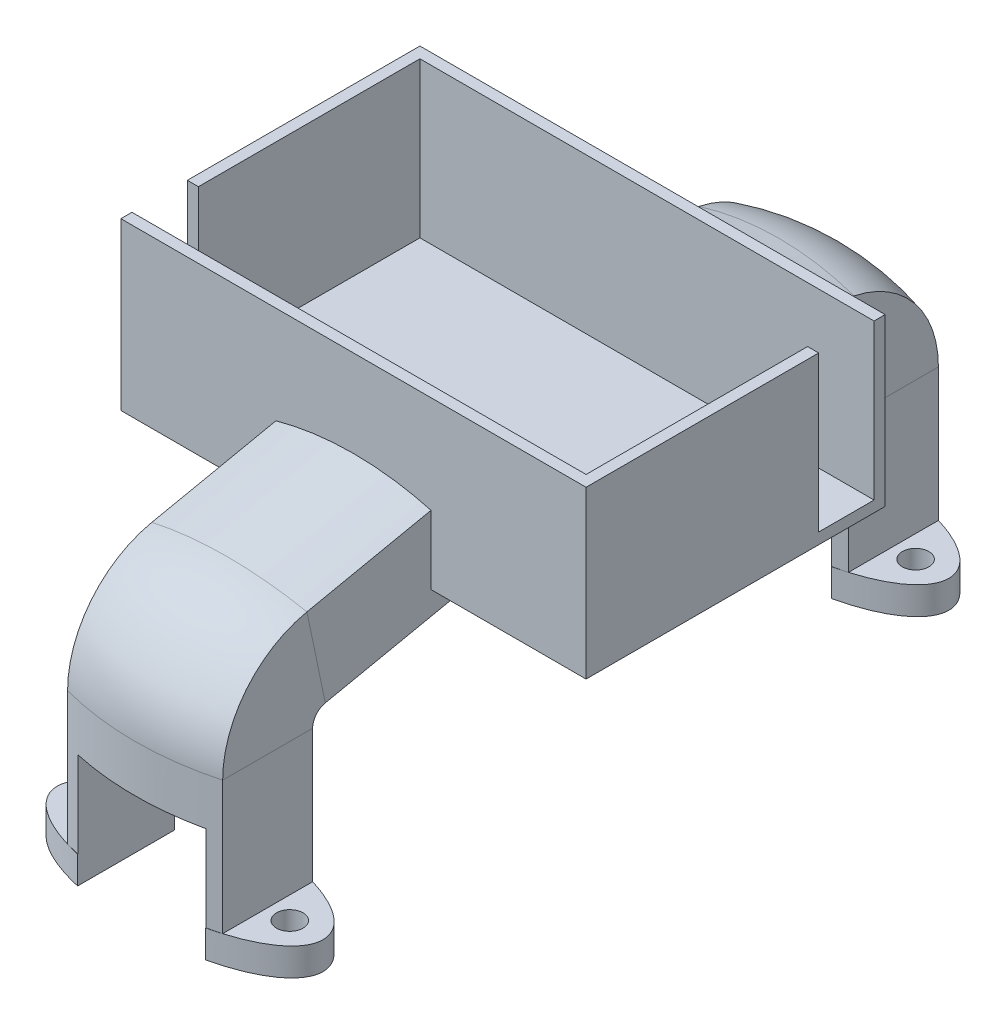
SolidWorks part; units mm, degrees
ref_plane "Front Plane" through (0, 0, 0) normal (0, 0, 1) x (1, 0, 0)
ref_plane "Top Plane" through (0, 0, 0) normal (0, 1, 0) x (1, 0, 0)
ref_plane "Right Plane" through (0, 0, 0) normal (1, 0, 0) x (0, 0, -1)
sketch "Sketch2" plane through (0, 0, 0) normal (0, 1, 0) x (1, 0, 0)
  ellipse E0 centre (0, 0) end of major axis (12, 0) minor radius 5
extrude "Boss-Extrude1" add sketch "Sketch2" along normal blind 2.5
sketch "Sketch3" plane through (0, 2.5, 0) normal (0, 1, 0) x (1, 0, 0)
  circle A0 centre (9, 0) radius 1.2
  circle A1 centre (-9, 0) radius 1.2
  dimension "D1" = 18
  dimension "D2" = 9
extrude "Cut-Extrude1" cut sketch "Sketch3" against normal blind 2.5
sketch "Sketch10" plane through (0, 2.5, 0) normal (0, 1, 0) x (1, 0, 0)
  line L0 (-7, -4.0612) -> (-7, 4.0612)
  line L1 (7, -4.0612) -> (7, 4.0612)
  arc A0 (-7, 4.0612) -> (7, 4.0612) centre (0, -21.915) cw
  arc A1 (-7, -4.0612) -> (7, -4.0612) centre (0, 21.9152) ccw
  ellipse E0 centre (0, 0) end of major axis (12, 0) minor radius 5 construction
  point P0 (7, 0)
  point P1 (-7, 0)
  point P12 (-7, 0)
  point P15 (7, 0)
  point P16 (0, -5)
  dimension "D1" = 7
  dimension "D2" = 7
extrude "Boss-Extrude3" add sketch "Sketch10" along normal blind 9
ref_plane "Plane1" through (0, 0, 10) normal (0, 0, 1) x (1, 0, 0)
sketch "Sketch11" plane through (0, 0, 10) normal (0, 0, 1) x (1, 0, 0)
  line L0 (-5.775, 0) -> (5.775, 0)
  line L1 (15.1989, 0) -> (-15.1989, 0) construction
  line L2 (5.775, 0) -> (5.775, 10.25)
  line L3 (5.775, 10.25) -> (-5.775, 10.25)
  line L4 (-5.775, 10.25) -> (-5.775, 0)
  point P6 (0, 0)
  dimension "D1" = 5.775
extrude "Cut-Extrude3" cut sketch "Sketch11" against normal blind 20
sketch "Sketch12" plane through (0, 0, 0) normal (0, 1, 0) x (1, 0, 0)
  ellipse E0 centre (0, 56.5) end of major axis (12, 56.5) minor radius 5
  dimension "D1" = 56.5
extrude "Boss-Extrude4" add sketch "Sketch12" along normal blind 2.5 separate body
sketch "Sketch14" plane through (0, 2.5, 0) normal (0, 1, 0) x (1, 0, 0)
  circle A0 centre (9, 56.5) radius 1.2
  circle A1 centre (-9, 56.5) radius 1.2
  ellipse E0 centre (0, 56.5) end of major axis (12, 56.5) minor radius 5 construction
  point P0 (-12, 56.5)
  point P1 (0, 56.5)
  point P13 (12, 56.5)
  dimension "D1" = 18
  dimension "D2" = 3
extrude "Cut-Extrude4" cut sketch "Sketch14" against normal blind 2.5
sketch "Sketch16" plane through (0, 2.5, 0) normal (0, 1, 0) x (1, 0, 0)
  line L0 (-7, 60.5612) -> (-7, 52.4388)
  line L1 (7, 60.5612) -> (7, 52.4388)
  arc A0 (-7, 60.5612) -> (7, 60.5612) centre (0, 34.9344) cw
  arc A1 (-7, 52.4388) -> (7, 52.4388) centre (0, 78.0656) ccw
  ellipse E0 centre (0, 56.5) end of major axis (12, 56.5) minor radius 5 construction
  point P8 (0, 56.5)
  point P13 (7, 56.4287)
  dimension "D1" = 7
extrude "Boss-Extrude5" add sketch "Sketch16" along normal blind 9
ref_plane "Plane2" through (0, 20, 0) normal (0, 1, 0) x (1, 0, 0)
sketch "Sketch17" plane through (0, 20, 0) normal (0, 1, 0) x (1, 0, 0)
  line L0 (-20, 15.75) -> (-20, 40.75)
  line L1 (-20, 15.75) -> (20, 15.75)
  line L2 (-20, 40.75) -> (20, 40.75)
  line L3 (20, 15.75) -> (20, 40.75)
  line L4 (-20, 15.75) -> (20, 40.75) construction
  line L5 (-20, 40.75) -> (20, 15.75) construction
  line L6 (-21, 14.75) -> (-21, 41.75)
  line L7 (-21, 14.75) -> (21, 14.75)
  line L8 (-21, 41.75) -> (21, 41.75)
  line L9 (21, 14.75) -> (21, 41.75)
  line L10 (-21, 14.75) -> (21, 41.75) construction
  line L11 (-21, 41.75) -> (21, 14.75) construction
  point P0 (0, 28.25)
  point P2 (0, 28.25)
  point P3 (0, 28.25)
extrude "Boss-Extrude6" add sketch "Sketch17" along normal blind 15 separate body
sketch "Sketch18" plane through (0, 20, 0) normal (0, 1, 0) x (1, 0, 0)
  line L1 (-20, 40.75) -> (20, 40.75)
  line L2 (-20, 40.75) -> (-20, 15.75)
  line L3 (-20, 15.75) -> (20, 15.75)
  line L4 (20, 40.75) -> (20, 15.75)
extrude "Boss-Extrude7" add sketch "Sketch18" along normal blind 1.5
ref_plane "Plane3" through (0, 0, -50) normal (0, 0, 1) x (1, 0, 0)
sketch "Sketch19" plane through (0, 0, -50) normal (0, 0, 1) x (1, 0, 0)
  line L0 (-5.775, 0) -> (5.775, 0)
  line L2 (5.775, 0) -> (5.775, 10.25)
  line L3 (5.775, 10.25) -> (-5.775, 10.25)
  line L4 (-5.775, 10.25) -> (-5.775, 0)
  point P6 (0, 0)
  dimension "D1" = 5.775
extrude "Cut-Extrude5" cut sketch "Sketch19" against normal blind 13
sketch "Sketch20" plane through (0, 11.5, 0) normal (0, 1, 0) x (1, 0, 0)
  line L0 (-7, 60.5612) -> (-7, 52.4388)
  line L1 (7, 60.5612) -> (7, 52.4388)
  arc A0 (-7, 60.5612) -> (7, 60.5612) centre (0, 34.9344) cw
  arc A1 (-7, 52.4388) -> (7, 52.4388) centre (0, 78.0656) ccw
  point P10 (7, 56.5)
  point P11 (0, 56.5)
  point P12 (0, 61.5)
sketch "Sketch21" plane through (0, 0, 0) normal (1, 0, 0) x (0, 0, -1)
  line L0 (56.5, 11.5) -> (56.5, 14.5)
  line L4 (52.1232, 19.8841) -> (34.5025, 23.56)
  arc A0 (56.5, 14.5) -> (52.1232, 19.8841) centre (51, 14.5) ccw
  dimension "D1" = 5.5
sweep "Sweep6" add profiles "Sketch20" path "Sketch21"
sketch "Sketch32" plane through (0, 11.5, 0) normal (0, 1, 0) x (1, 0, 0)
  line L0 (-7, 4.0612) -> (-7, -4.0612)
  line L1 (7, 4.0612) -> (7, -4.0612)
  arc A0 (-7, 4.0612) -> (7, 4.0612) centre (0, -21.915) cw
  arc A1 (-7, -4.0612) -> (7, -4.0612) centre (0, 21.9152) ccw
sketch "Sketch33" plane through (0, 0, 0) normal (1, 0, 0) x (0, 0, -1)
  line L4 (4.3768, 19.8841) -> (21.9975, 23.56)
  line L5 (0, 11.5) -> (0, 14.5)
  arc A1 (0, 14.5) -> (4.3768, 19.8841) centre (5.5, 14.5) cw
sweep "Sweep7" add profiles "Sketch32" path "Sketch33"
sketch "Sketch34" plane through (0, 35, 0) normal (0, 1, 0) x (1, 0, 0)
  line L1 (-20, 40.75) -> (20, 40.75)
  line L2 (-20, 40.75) -> (-20, 15.75)
  line L3 (-20, 15.75) -> (20, 15.75)
  line L4 (20, 40.75) -> (20, 15.75)
extrude "Cut-Extrude6" cut sketch "Sketch34" against normal blind 14
sketch "Sketch35" plane through (0, 35, 0) normal (0, 1, 0) x (1, 0, 0)
  line L0 (-21, 41.75) -> (-21, 14.75) construction
  line L1 (-20, 15.75) -> (-21, 15.75)
  line L2 (-20, 15.75) -> (-20, 20.75)
  line L3 (-20, 20.75) -> (-21, 20.75)
  line L4 (-21, 15.75) -> (-21, 20.75)
  line L5 (21, 14.75) -> (21, 41.75) construction
  line L6 (20, 40.75) -> (21, 40.75)
  line L7 (20, 40.75) -> (20, 35.75)
  line L8 (20, 35.75) -> (21, 35.75)
  line L9 (21, 40.75) -> (21, 35.75)
extrude "Cut-Extrude7" cut sketch "Sketch35" against normal blind 14
